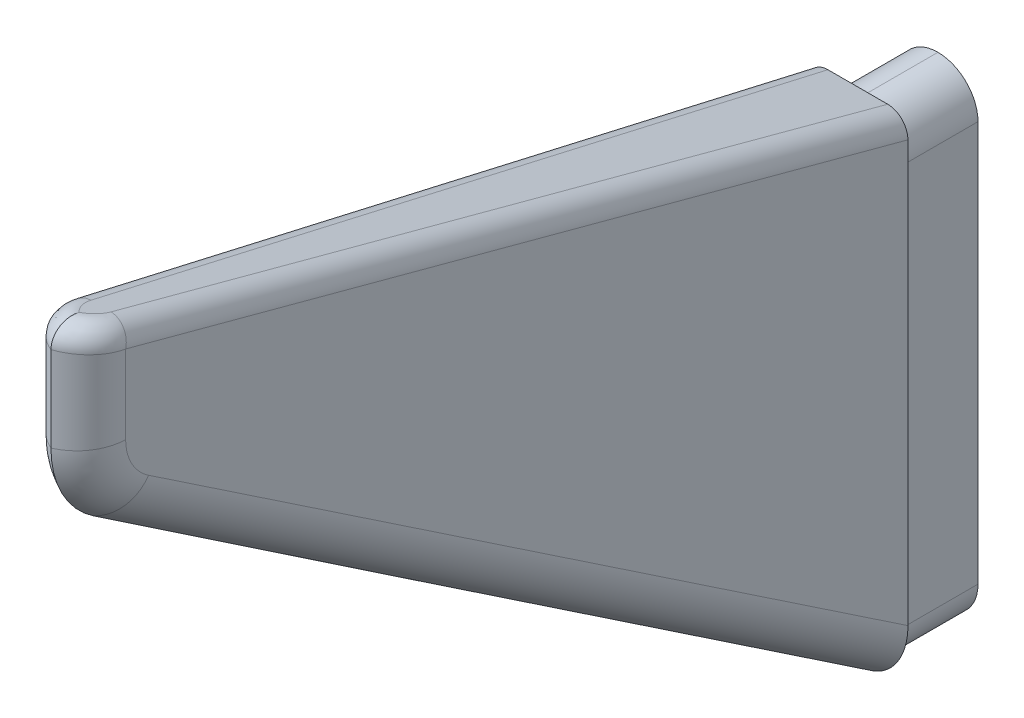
SolidWorks part; units mm, degrees
ref_plane "Plan de face" through (0, 0, 0) normal (0, 0, 1) x (1, 0, 0)
ref_plane "Plan de dessus" through (0, 0, 0) normal (0, 1, 0) x (1, 0, 0)
ref_plane "Plan de droite" through (0, 0, 0) normal (1, 0, 0) x (0, 0, -1)
sketch "Esquisse1" plane through (0, 0, 0) normal (0, 0, 1) x (1, 0, 0)
  line L1 (-2, 12) -> (2, 12)
  line L2 (-2, 12) -> (-2, -12)
  line L3 (-2, -12) -> (2, -12)
  line L4 (2, 12) -> (2, -12)
  dimension "D1" = 2
  dimension "D2" = 4
  dimension "D3" = 12
  dimension "D4" = 24
extrude "Boss.-Extru.1" add sketch "Esquisse1" against normal blind 4
fillet "Congé1" radius 2 4 edges at (-2, 12, -2) (2, 12, -2) (2, -12, -2) (-2, -12, -2)
sketch "Esquisse2" plane through (0, 0, 0) normal (1, 0, 0) x (0, 0, -1)
  line L0 (0, -10) -> (0, 10) construction
  line L1 (0, -10) -> (0, 10)
  line L2 (0, 10) -> (0, 12.5)
  line L3 (0, -10) -> (0, -12.5)
  line L4 (-40.5, 22.5978) -> (-40.5, 17.0321)
  line L5 (0, 12.5) -> (-40.5, 22.5978)
  line L6 (0, -12.5) -> (-38.2626, 12.8646)
  arc A0 (-38.2626, 12.8646) -> (-40.5, 17.0321) centre (-35.5, 17.0321) cw
  point P7 (-40.5, 14.3478)
  dimension "D6" = 5
  dimension "D1" = 40.5
  dimension "D2" = 76
  dimension "D3" = 2.5
  dimension "D4" = 2.5
  dimension "D5" = 8.25
extrude "Boss.-Extru.2" add sketch "Esquisse2" along normal mid plane 5
draft "Dépouille1" type of draft neutral plane draft angle 1.5 faces to draft 2 parameters "D1"=1.5
fillet "Congé2" radius 2.5 6 edges at (-1.4395, 19.8149, 40.5) (-1.455, 14.6671, 39.9053) (1.4395, 19.8149, 40.5) (1.455, 14.6671, 39.9053) (-1.999, 0.1823, 19.1313) (1.999, 0.1823, 19.1313)
fillet "Congé3" radius 1 4 edges at (-1.0764, 22.3231, 39.3984) (1.0764, 22.3231, 39.3984) (-2.0016, 17.2454, 19.0327) (2.0016, 17.2454, 19.0327)
